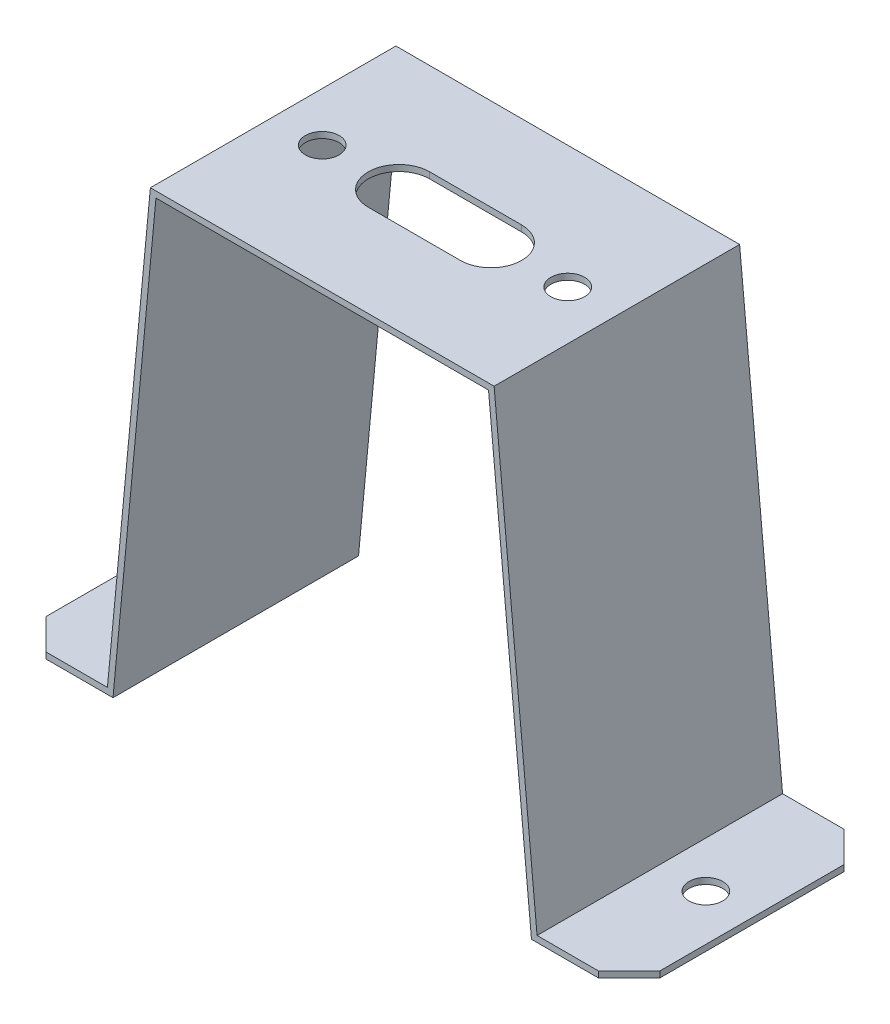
SolidWorks part; units mm, degrees
ref_plane "Front" through (0, 0, 0) normal (0, 0, 1) x (1, 0, 0)
ref_plane "Top" through (0, 0, 0) normal (0, 1, 0) x (1, 0, 0)
ref_plane "Right" through (0, 0, 0) normal (1, 0, 0) x (0, 0, -1)
sketch "Sketch1" plane through (0, 0, 0) normal (0, 0, 1) x (1, 0, 0)
  line L0 (0, 0) -> (15.9099, 0)
  line L1 (22.9956, 74.9058) -> (15.9956, 0.9058) construction
  line L2 (22, 74) -> (78, 74) construction
  line L3 (77.0044, 74.9058) -> (84.0044, 0.9058) construction
  line L4 (100, 0) -> (100, 1)
  line L5 (0, 0) -> (0, 1)
  line L6 (78, 75) -> (85, 1)
  line L7 (77.0901, 74) -> (84.0901, 0)
  line L8 (22, 75) -> (78, 75)
  line L9 (22.9099, 74) -> (77.0901, 74)
  line L10 (0, 1) -> (15, 1)
  line L11 (85, 1) -> (100, 1)
  line L12 (0, 1) -> (100, 1) construction
  line L13 (22, 75) -> (15, 1)
  line L14 (22.9099, 74) -> (15.9099, 0)
  line L15 (84.0901, 0) -> (100, 0)
  line L16 (0, 0) -> (100, 0) construction
extrude "Extrude1" add sketch "Sketch1" along normal blind 40
sketch "Sketch2" plane through (0, 75, 0) normal (0, 1, 0) x (-1, 0, 0)
  line L10 (-42.5, 25) -> (-57.5, 25)
  line L11 (-42.5, 15) -> (-57.5, 15)
  circle A0 centre (-70, 20) radius 2.75
  circle A1 centre (-30, 20) radius 2.75
  arc A2 (-42.5, 15) -> (-42.5, 25) centre (-42.5, 20) ccw
  arc A3 (-57.5, 25) -> (-57.5, 15) centre (-57.5, 20) ccw
extrude "Cut-Extrude1" cut sketch "Sketch2" against normal blind 40
sketch "Sketch3" plane through (0, 1, 0) normal (0, 1, 0) x (-1, 0, 0)
  circle A0 centre (-92.5, 20) radius 2.75
  circle A1 centre (-7.5, 20) radius 2.75
extrude "Cut-Extrude2" cut sketch "Sketch3" against normal blind 40
chamfer "Chamfer1" distance 5 2 edges at (0, 0.5, 40) (0, 0.5, 0)
chamfer "Chamfer2" distance 5 angle 45 2 edges at (100, 0.5, 40) (100, 0.5, 0)
